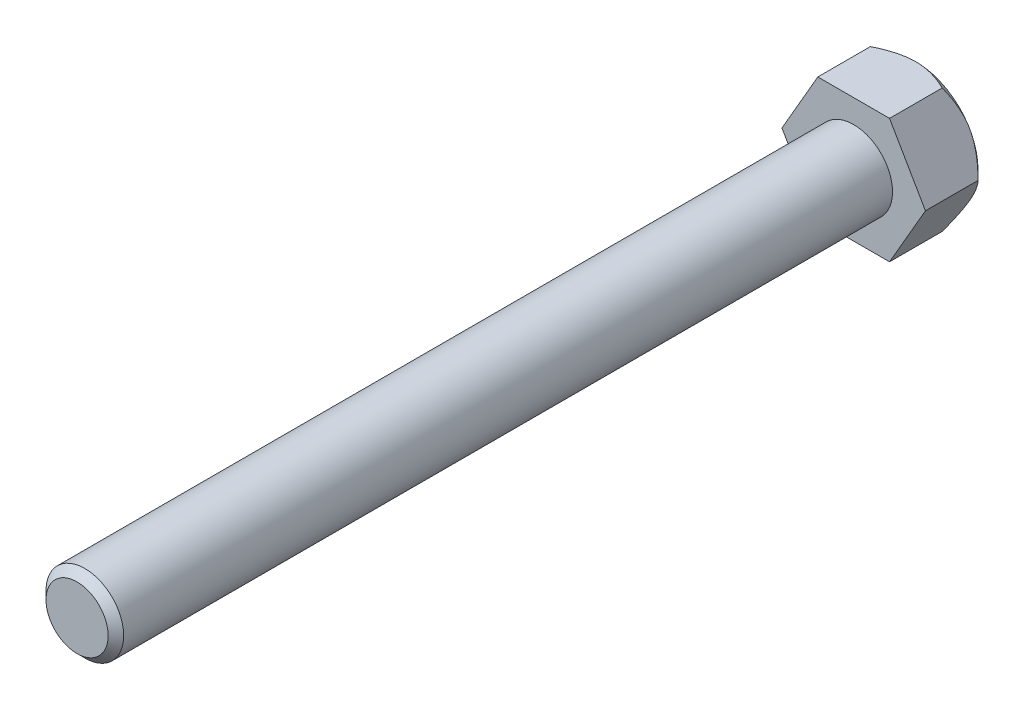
SolidWorks part; units mm, degrees
ref_plane "Plan de face" through (0, 0, 0) normal (0, 0, 1) x (1, 0, 0)
ref_plane "Plan de dessus" through (0, 0, 0) normal (0, 1, 0) x (1, 0, 0)
ref_plane "Plan de droite" through (0, 0, 0) normal (1, 0, 0) x (0, 0, -1)
sketch "Esquisse1" plane through (0, 0, 0) normal (0, 0, 1) x (1, 0, 0)
  line L1 (4.6188, 0) -> (2.3094, 4)
  line L2 (2.3094, 4) -> (-2.3094, 4)
  line L3 (-2.3094, 4) -> (-4.6188, 0)
  line L4 (-4.6188, 0) -> (-2.3094, -4)
  line L5 (-2.3094, -4) -> (2.3094, -4)
  line L6 (2.3094, -4) -> (4.6188, 0)
  circle A0 centre (0, 0) radius 4 construction
  dimension "D1" = 8
extrude "Extrusion1" add sketch "Esquisse1" along normal blind 4
sketch "Esquisse2" plane through (0, 0, 4) normal (0, 0, 1) x (1, 0, 0)
  circle A0 centre (0, 0) radius 2.5
  dimension "D1" = 5
extrude "Extrusion2" add sketch "Esquisse2" along normal blind 50
sketch "Esquisse3" plane through (0, 0, 0) normal (0, 1, 0) x (1, 0, 0)
  line L0 (4.6188, 0) -> (4.0034, 0)
  line L1 (4.6188, 0) -> (2.3094, 0) construction
  line L2 (4.0034, 0) -> (4.6188, -0.6154)
  line L3 (4.6188, -4) -> (4.6188, 0) construction
  line L4 (4.6188, -0.6154) -> (4.6188, 0)
  line L5 (0, 0) -> (0, -14.3949) construction
  dimension "D1" = 45
  dimension "D2" = 0.6154
revolve "Enlèvement de matière-Révolution1" cut sketch "Esquisse3" angle 360 about L5
chamfer "Chanfrein1" distance 0.5 angle 45 1 edges at (2.5, 0, 54)
equation "\"D1@Extrusion1\" = 0.8*\"D1@Esquisse2\""
equation "\"D2@Esquisse3\"=\"D1@Esquisse1\"/13"
equation "\"D1@Chanfrein1\"=\"D1@Esquisse2\"/10"
